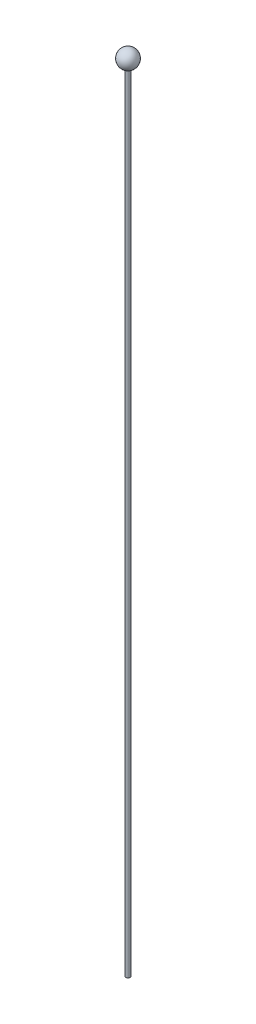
SolidWorks part; units mm, degrees
ref_plane "Front Plane" through (0, 0, 0) normal (0, 0, 1) x (1, 0, 0)
ref_plane "Top Plane" through (0, 0, 0) normal (0, 1, 0) x (1, 0, 0)
ref_plane "Right Plane" through (0, 0, 0) normal (1, 0, 0) x (0, 0, -1)
sketch "Sketch1" plane through (0, 0, 0) normal (0, 0, 1) x (1, 0, 0)
  line L0 (0, 0) -> (0, 90)
  line L1 (0, 0) -> (0, 331.2662) construction
  line L2 (0, 91) -> (0, 90)
  line L3 (0.25, 89.0318) -> (0.25, 0)
  line L4 (0.25, 0) -> (0, 0)
  arc A0 (0.25, 89.0318) -> (0, 91) centre (0, 90) ccw
  dimension "D2" = 0.5
  dimension "D3" = 2
  dimension "D1" = 90
revolve "Revolve1" add sketch "Sketch1" angle 360 about L1
